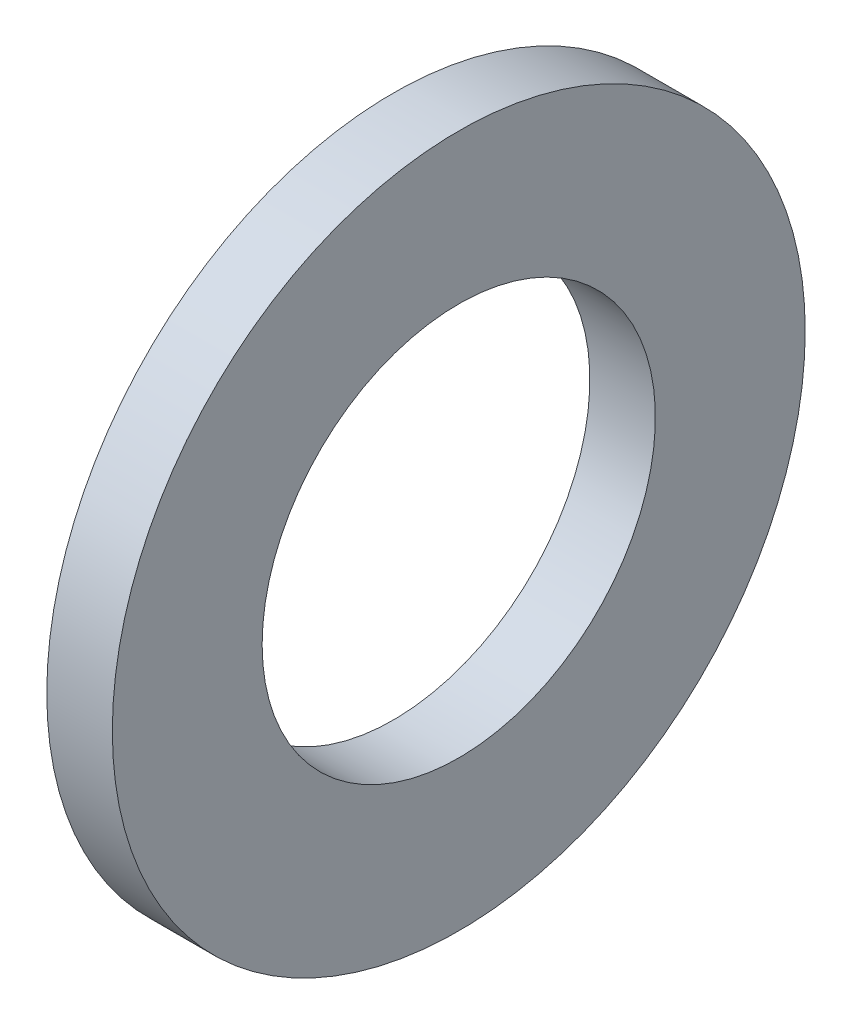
SolidWorks part; units mm, degrees
ref_plane "Plane1" through (0, 0, 0) normal (0, 0, 1) x (1, 0, 0)
ref_plane "Plane2" through (0, 0, 0) normal (0, 1, 0) x (1, 0, 0)
ref_plane "Plane3" through (0, 0, 0) normal (1, 0, 0) x (0, 0, -1)
other "Configuration Table"
sketch "Sketch1" plane through (0, 0, 0) normal (0, 0, 1) x (1, 0, 0)
  line L0 (-34.925, 0) -> (9.525, 0) construction
  line L1 (0, 10.5) -> (0, 18.5)
  line L2 (0, 18.5) -> (-3.5, 18.5)
  line L3 (-3.5, 18.5) -> (-3.5, 10.5)
  line L4 (-3.5, 10.5) -> (0, 10.5)
  dimension "Thickness" = 3.5
  dimension "Inside_dia" = 21
  dimension "Outside_dia" = 37
revolve "Base-Revolve" add sketch "Sketch1" angle 360 about L0
